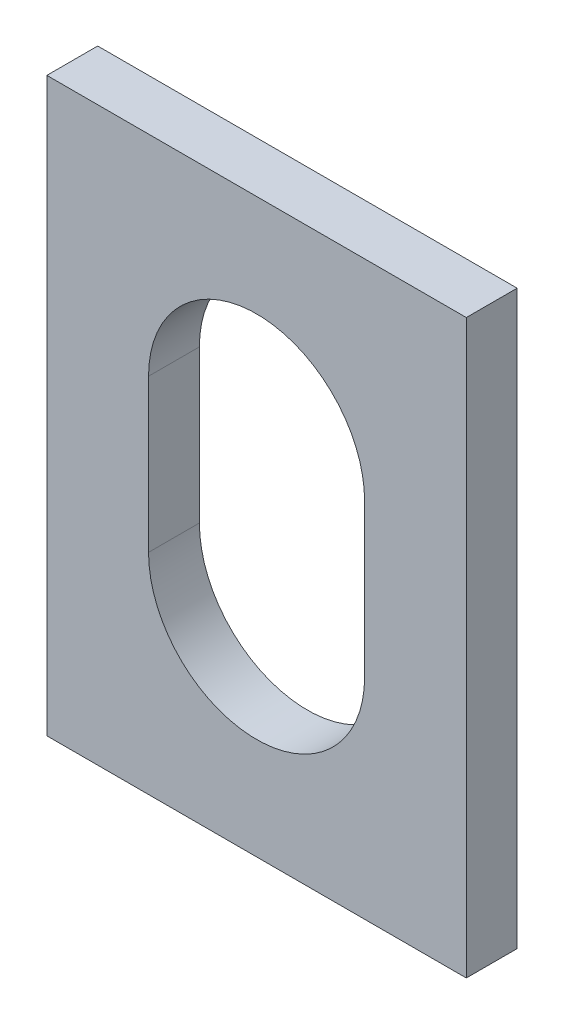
SolidWorks part; units mm, degrees
ref_plane "Front Plane" through (0, 0, 0) normal (0, 0, 1) x (1, 0, 0)
ref_plane "Top Plane" through (0, 0, 0) normal (0, 1, 0) x (1, 0, 0)
ref_plane "Right Plane" through (0, 0, 0) normal (1, 0, 0) x (0, 0, -1)
sketch "Sketch1" plane through (0, 0, 0) normal (0, 0, 1) x (1, 0, 0)
  line L0 (8.5, 0) -> (8.5, 12)
  line L1 (-8.5, 0) -> (-8.5, 12)
  line L2 (0, 12) -> (0, 0) construction
  line L3 (-16.5, 28.5) -> (16.5, 28.5)
  line L4 (-16.5, 28.5) -> (-16.5, -16.5)
  line L5 (-16.5, -16.5) -> (16.5, -16.5)
  line L6 (16.5, 28.5) -> (16.5, -16.5)
  line L7 (16.5, 28.5) -> (-16.5, -16.5) construction
  arc A0 (-8.5, 0) -> (8.5, 0) centre (0, 0) ccw
  arc A1 (-8.5, 12) -> (8.5, 12) centre (0, 12) cw
  point P11 (0, 6)
  dimension "D1" = 17
  dimension "D2" = 33
  dimension "D3" = 12
  dimension "D4" = 45
extrude "Boss-Extrude1" add sketch "Sketch1" along normal blind 4
